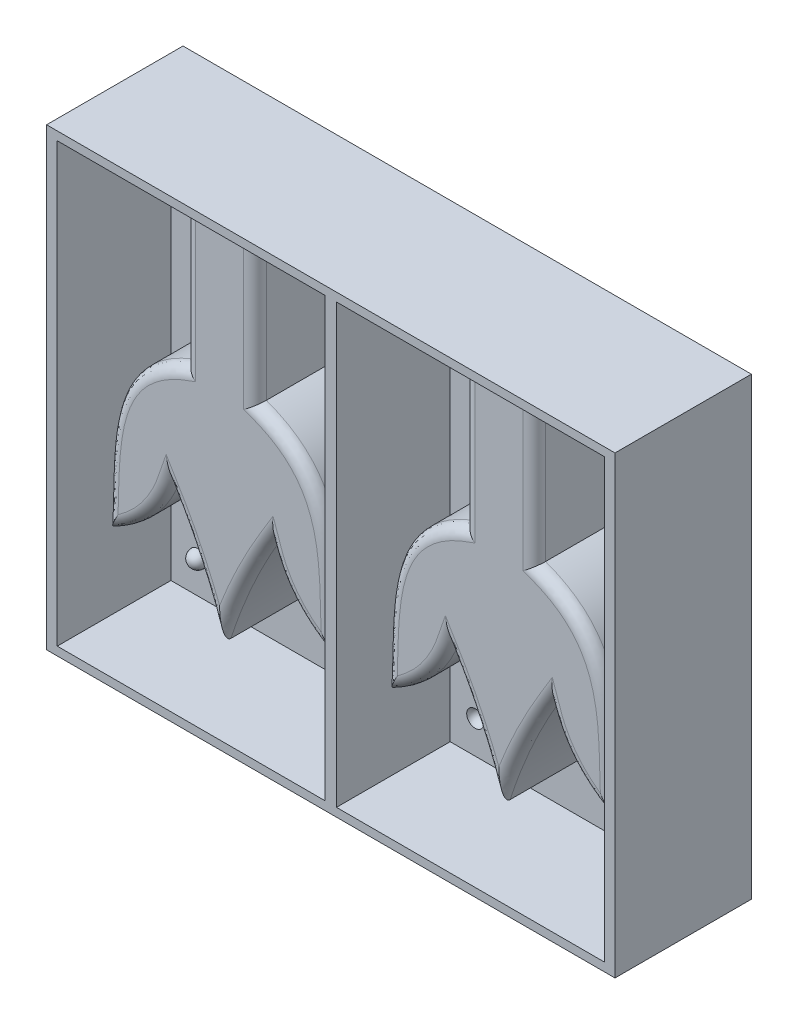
SolidWorks part; units mm, degrees
ref_plane "Front Plane" through (0, 0, 0) normal (0, 0, 1) x (1, 0, 0)
ref_plane "Top Plane" through (0, 0, 0) normal (0, 1, 0) x (1, 0, 0)
ref_plane "Right Plane" through (0, 0, 0) normal (1, 0, 0) x (0, 0, -1)
sketch "Sketch1" plane through (0, 0, 0) normal (0, 0, 1) x (1, 0, 0)
  line L1 (-50, 40) -> (50, 40)
  line L2 (-50, 40) -> (-50, -40)
  line L3 (-50, -40) -> (50, -40)
  line L4 (50, 40) -> (50, -40)
  line L5 (-50, 40) -> (50, -40) construction
  line L6 (-50, -40) -> (50, 40) construction
  point P0 (0, 0)
  dimension "D1" = 100
  dimension "D2" = 80
extrude "Boss-Extrude1" add sketch "Sketch1" along normal blind 4
sketch "Sketch2" plane through (0, 0, 4) normal (0, 0, 1) x (1, 0, 0)
  line L1 (-50, 40) -> (50, 40)
  line L2 (-50, 40) -> (-50, -40)
  line L3 (-50, -40) -> (50, -40)
  line L4 (50, 40) -> (50, -40)
  line L5 (-50, 40) -> (50, -40) construction
  line L6 (-50, -40) -> (50, 40) construction
  line L7 (-48.125, 38.5) -> (48.125, 38.5)
  line L8 (-48.125, 38.5) -> (-48.125, -38.5)
  line L9 (-48.125, -38.5) -> (48.125, -38.5)
  line L10 (48.125, 38.5) -> (48.125, -38.5)
  line L11 (-48.125, 38.5) -> (48.125, -38.5) construction
  line L12 (-48.125, -38.5) -> (48.125, 38.5) construction
  point P0 (0, 0)
  point P7 (0, 0)
  dimension "D1" = 77
  dimension "D2" = 96.25
extrude "Boss-Extrude2" add sketch "Sketch2" along normal blind 20
sketch "Sketch3" plane through (0, 0, 4) normal (0, 0, 1) x (1, 0, 0)
  line L0 (0, 54.9317) -> (0, -53.7539) construction
  line L1 (-74.6492, 0) -> (70.1565, 0) construction
  line L2 (-48.125, -38.5) -> (48.125, -38.5) construction
  line L3 (-1, 38.5) -> (1, 38.5)
  line L4 (-1, 38.5) -> (-1, -38.5)
  line L5 (-1, -38.5) -> (1, -38.5)
  line L6 (1, 38.5) -> (1, -38.5)
  line L7 (-1, 38.5) -> (1, -38.5) construction
  line L8 (-1, -38.5) -> (1, 38.5) construction
  point P5 (0, 0)
  dimension "D1" = 2
extrude "Boss-Extrude3" add sketch "Sketch3" along normal blind 20
sketch "Sketch6" plane through (0, 0, 4) normal (0, 0, 1) x (1, 0, 0)
  line L0 (-60.3511, 0) -> (-42.1665, 0) construction
  line L1 (0, 49.3933) -> (0, -50.7822) construction
  line L4 (-30.7875, 38.5) -> (-18.3375, 38.5)
  line L5 (-30.7875, 38.5) -> (-30.7875, 10.3502)
  line L7 (-18.3375, 38.5) -> (-18.3375, 10.3502)
  line L8 (30.7875, 38.5) -> (30.7875, 10.3502)
  line L9 (18.3375, 38.5) -> (18.3375, 10.3502)
  line L10 (-24.5625, -38.5) -> (-24.5625, -48.1248) construction
  line L11 (30.7875, 38.5) -> (18.3375, 38.5)
  line L13 (-6.9585, 0) -> (61.7124, 0) construction
  spline S0 degree 3 poles (-30.7875, 10.3502) (-46.3904, 4.6814) (-43.7037, -9.6627) (-44.6096, -21.7481) knots 0 0 0 0 1 1 1 1
  spline S1 degree 2 poles (-44.6096, -21.7481) (-36.2907, -17.5826) (-33.469, -9.3942) knots 0 0 0 1 1 1
  spline S2 degree 2 poles (-33.469, -9.3942) (-27.854, -18.7106) (-24.5625, -29.0348) knots 0 0 0 1 1 1
  spline S3 degree 2 poles (-15.656, -9.3942) (-21.271, -18.7106) (-24.5625, -29.0348) knots 0 0 0 1 1 1
  spline S4 degree 2 poles (-4.5154, -21.7481) (-12.8343, -17.5826) (-15.656, -9.3942) knots 0 0 0 1 1 1
  spline S5 degree 3 poles (-18.3375, 10.3502) (-2.7346, 4.6814) (-5.4213, -9.6627) (-4.5154, -21.7481) knots 0 0 0 0 1 1 1 1
  spline S6 degree 3 poles (30.7875, 10.3502) (46.3904, 4.6814) (43.7037, -9.6627) (44.6096, -21.7481) knots 0 0 0 0 1 1 1 1
  spline S7 degree 2 poles (44.6096, -21.7481) (36.2907, -17.5826) (33.469, -9.3942) knots 0 0 0 1 1 1
  spline S8 degree 2 poles (33.469, -9.3942) (27.854, -18.7106) (24.5625, -29.0348) knots 0 0 0 1 1 1
  spline S9 degree 2 poles (15.656, -9.3942) (21.271, -18.7106) (24.5625, -29.0348) knots 0 0 0 1 1 1
  spline S10 degree 2 poles (4.5154, -21.7481) (12.8343, -17.5826) (15.656, -9.3942) knots 0 0 0 1 1 1
  spline S11 degree 3 poles (18.3375, 10.3502) (2.7346, 4.6814) (5.4213, -9.6627) (4.5154, -21.7481) knots 0 0 0 0 1 1 1 1
  point P7 (-24.5625, 0)
extrude "Boss-Extrude8" add sketch "Sketch6" along normal blind 15
fillet "Fillet18" radius 2 11 edges at (-18.3375, 38.5, 11.5) (-30.7875, 38.5, 11.5) (-24.5625, 38.5, 19) (-18.3375, 24.4251, 19) (-30.7875, 24.4251, 19)
fillet "Fillet19" radius 2 11 edges at (30.7875, 38.5, 11.5) (18.3375, 38.5, 11.5) (30.7875, 24.4251, 19) (18.3375, 24.4251, 19) (24.5625, 38.5, 19)
sketch "Sketch21" plane through (0, 0, 4) normal (0, 0, 1) x (1, 0, 0)
  line L0 (-43.4082, 37.1686) -> (-43.4082, 32.0327) construction
  line L1 (-43.4082, 32.738) -> (-43.4082, 35.738)
  arc A0 (-43.4082, 35.738) -> (-43.4082, 32.738) centre (-43.4082, 34.238) ccw
  point P0 (-43.4082, 34.238)
  point P1 (-5.4082, 34.238)
  point P2 (-43.4082, -34.762)
  point P3 (-5.3975, -34.762)
  dimension "D3" = 3
  dimension "D1" = 38
  dimension "D2" = 69
revolve "Revolve38" add sketch "Sketch21" angle 360 about L0
pattern_linear "LPattern2" count 2 spacing 38 along (1, 0, 0) count 2 spacing 67 along (0, -1, 0) of "Revolve38"
sketch "Sketch25" plane through (0, 0, 24) normal (0, 0, 1) x (1, 0, 0)
  line L0 (0, 43.6184) -> (0, -41.9168) construction
ref_plane "Plane3" through (0, 0, 0) normal (-1, 0, 0) x (0, -1, 0)
mirror "Mirror10" about plane through (0, 0, 0) normal (-1, 0, 0) of "Revolve38"
pattern_linear "LPattern4" count 2 spacing 38 along (-1, 0, 0) of "Mirror10"
pattern_linear "LPattern5" count 2 spacing 67 along (0, -1, 0) of "LPattern4"
pattern_linear "LPattern9" count 2 spacing 38 along (1, 0, 0) of "LPattern5"
sketch "Sketch31" plane through (0, 0, 4) normal (0, 0, 1) x (1, 0, 0)
  line L0 (43.4082, 35.738) -> (43.4082, 32.738)
  arc A0 (43.4082, 32.738) -> (43.4082, 35.738) centre (43.4082, 34.238) ccw
revolve "Cut-Revolve14" cut sketch "Sketch31" angle 360 about L0
sketch "Sketch32" plane through (0, 0, 4) normal (0, 0, 1) x (1, 0, 0)
  line L0 (5.4082, 35.738) -> (5.4082, 32.738)
  arc A0 (5.4082, 32.738) -> (5.4082, 35.738) centre (5.4082, 34.238) ccw
revolve "Cut-Revolve15" cut sketch "Sketch32" angle 360 about L0
sketch "Sketch33" plane through (0, 0, 4) normal (0, 0, 1) x (1, 0, 0)
  line L0 (43.4082, -31.262) -> (43.4082, -34.262)
  arc A0 (43.4082, -34.262) -> (43.4082, -31.262) centre (43.4082, -32.762) ccw
revolve "Cut-Revolve16" cut sketch "Sketch33" angle 360 about L0
sketch "Sketch34" plane through (0, 0, 4) normal (0, 0, 1) x (1, 0, 0)
  line L0 (5.4082, -31.262) -> (5.4082, -34.262)
  arc A0 (5.4082, -34.262) -> (5.4082, -31.262) centre (5.4082, -32.762) ccw
revolve "Cut-Revolve17" cut sketch "Sketch34" angle 360 about L0
